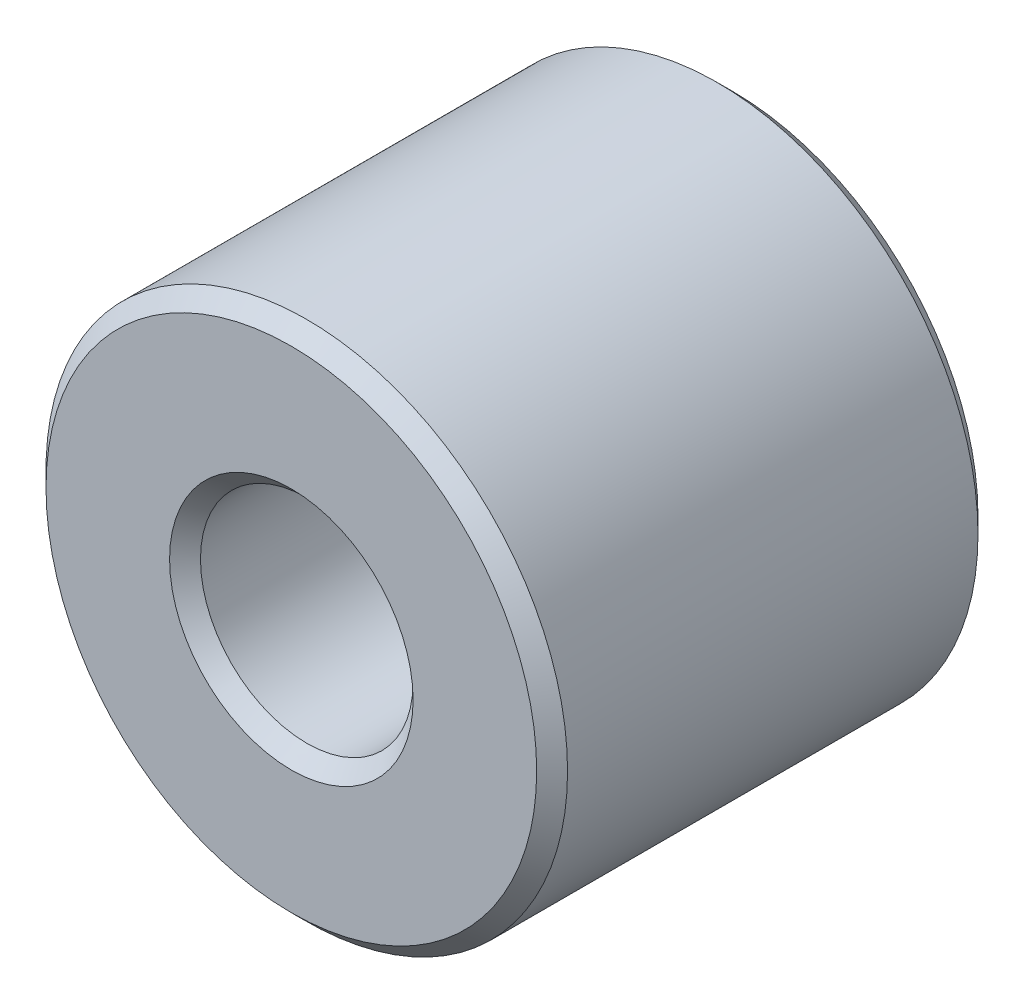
SolidWorks part; units mm, degrees
ref_plane "Front Plane" through (0, 0, 0) normal (0, 0, 1) x (1, 0, 0)
ref_plane "Top Plane" through (0, 0, 0) normal (0, 1, 0) x (1, 0, 0)
ref_plane "Right Plane" through (0, 0, 0) normal (1, 0, 0) x (0, 0, -1)
sketch "Sketch1" plane through (0, 0, 0) normal (0, 0, 1) x (1, 0, 0)
  circle A0 centre (0, 0) radius 6.5 construction
  circle A1 centre (0, 0) radius 2.65 construction
  point P4 (0, 6.5)
sketch "Sketch2" plane through (0, 0, 0) normal (1, 0, 0) x (0, 0, -1)
  line L0 (-5.5, 6.5) -> (5.5, 6.5) construction
  dimension "Length" = 11
sketch "Sketch3" plane through (0, 0, 0) normal (0, 0, 1) x (1, 0, 0)
  circle A0 centre (0, 0) radius 2.65 construction
  circle A1 centre (0, 0) radius 6.5 construction
  circle A2 centre (0, 0) radius 2.65
  circle A3 centre (0, 0) radius 6.5
extrude "Boss-Extrude1" add sketch "Sketch3" against normal up to vertex (5.5 mm away) and the other way up to vertex (5.5 mm away)
chamfer "Chamfer1" distance 0.385 angle 45 4 edges at (6.5, 0, 5.5) (6.5, 0, -5.5) (2.65, 0, 5.5) (2.65, 0, -5.5)
equation "\"D1@Chamfer1\"=(\"OD@Sketch1\"-\"ID@Sketch1\")*0.05"
